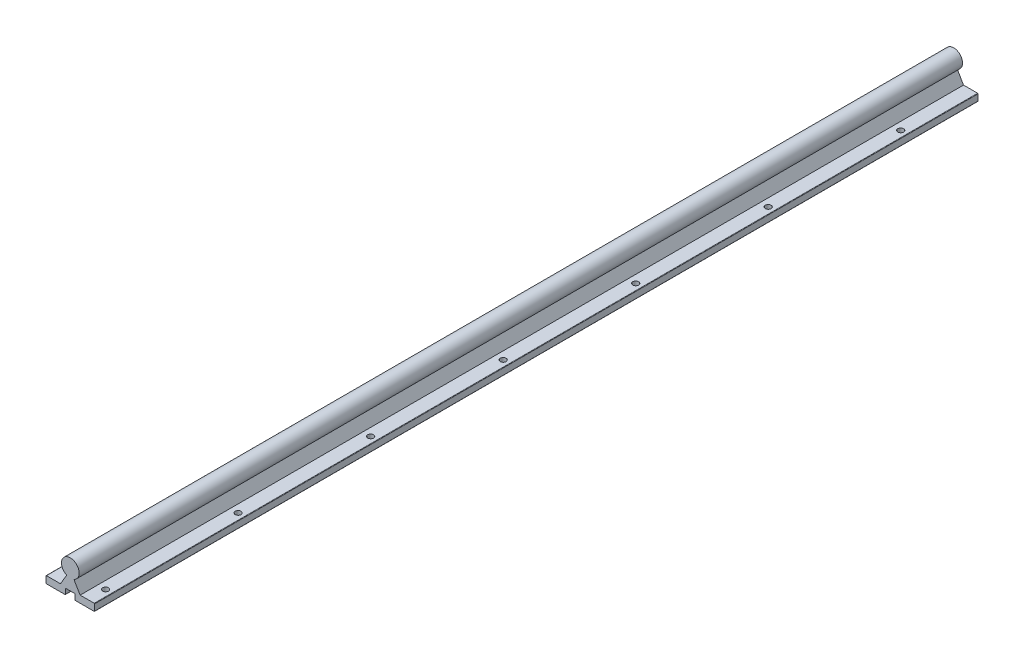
SolidWorks part; units mm, degrees
ref_plane "Front Plane" through (0, 0, 0) normal (0, 0, 1) x (1, 0, 0)
ref_plane "Top Plane" through (0, 0, 0) normal (0, 1, 0) x (1, 0, 0)
ref_plane "Right Plane" through (0, 0, 0) normal (1, 0, 0) x (0, 0, -1)
sketch "Sketch1" plane through (0, 0, 0) normal (0, 0, 1) x (1, 0, 0)
  line L0 (-5, 2.5) -> (5, 2.5)
  line L1 (-27, 4) -> (-11.1518, 4)
  line L2 (-27.5, 3.5) -> (-27.5, -3.5)
  line L3 (-27, -4) -> (-6, -4)
  line L4 (27.5, 3.5) -> (27.5, -3.5)
  line L5 (-27.5, 4) -> (-5.5, 0.8) construction
  line L6 (-27.5, -4) -> (-5.5, -0.8) construction
  line L8 (-5.5, 2) -> (-5.5, -3.5)
  line L10 (5.5, 2) -> (5.5, -3.5)
  line L13 (6, -4) -> (27, -4)
  line L14 (5.5, 0.8) -> (27.5, 4) construction
  line L15 (5.5, -0.8) -> (27.5, -4) construction
  line L16 (-11.1518, 4) -> (-4.3953, 15.395)
  line L17 (0, -55) -> (0, 55) construction
  line L18 (11.1518, 4) -> (4.3953, 15.395)
  line L19 (-3.9652, 15.64) -> (-3.52, 15.64)
  line L20 (3.52, 15.64) -> (3.9652, 15.64)
  line L22 (11.1518, 4) -> (27, 4)
  arc A0 (3.52, 15.64) -> (-3.52, 15.64) centre (0, 25) ccw
  arc A1 (4.3953, 15.395) -> (3.9652, 15.64) centre (3.9652, 15.14) ccw
  arc A2 (-4.3953, 15.395) -> (-3.9652, 15.64) centre (-3.9652, 15.14) cw
  arc A3 (27, -4) -> (27.5, -3.5) centre (27, -3.5) ccw
  arc A4 (27, 4) -> (27.5, 3.5) centre (27, 3.5) cw
  arc A5 (-5.5, -3.5) -> (-6, -4) centre (-6, -3.5) cw
  arc A6 (6, -4) -> (5.5, -3.5) centre (6, -3.5) cw
  arc A7 (5, 2.5) -> (5.5, 2) centre (5, 2) cw
  arc A8 (-5, 2.5) -> (-5.5, 2) centre (-5, 2) ccw
  arc A9 (-27.5, -3.5) -> (-27, -4) centre (-27, -3.5) ccw
  arc A10 (-27, 4) -> (-27.5, 3.5) centre (-27, 3.5) ccw
  point P0 (0, 0)
  point P6 (0, 0)
  point P16 (4.25, 15.64)
  point P29 (-4.25, 15.64)
  point P40 (5.5, -4)
  dimension "D8" = 20
  dimension "D9" = 0.5
  dimension "D1" = 8
  dimension "D2" = 55
  dimension "D3" = 11
  dimension "D4" = 6.5
  dimension "D5" = 19.64
  dimension "D6" = 8.5
  dimension "D7" = 29
extrude "Boss-Extrude1" add sketch "Sketch1" along normal blind 1000
sketch "Sketch2" plane through (0, 4, 0) normal (0, 1, 0) x (1, 0, 0)
  line L0 (27.5, -1000) -> (27.5, 0) construction
  line L1 (27, -1000) -> (11.1518, -1000) construction
  point P0 (20, -980)
  dimension "D1" = 7.5
  dimension "D2" = 20
hole_wizard "Ø6.6 (6.6) Diameter Hole1" positions "Sketch2" profile "Sketch3" hole size "Ø6.6" standard "DIN"
sketch "Sketch3" plane through (20, 4, 980) normal (1, 0, 0) x (0, 0, 1)
  line L0 (0, 0) -> (0, 8)
  line L1 (0, 8) -> (3.3, 8)
  line L2 (3.3, 8) -> (3.3, 0)
  line L5 (3.3, 0) -> (0, 0)
  line L11 (0, -6.35) -> (0, 107.95) construction
  dimension "Thru Hole Dia." = 6.6
  dimension "Thru Hole Depth" = 8
mirror "Mirror1" about plane through (0, 0, 0) normal (1, 0, 0) of "Ø6.6 (6.6) Diameter Hole1"
other "Fill Pattern1" parameters "D5"=0, "D6"=0, "D1"=150, "D2"=60, "D3"=0, "D9"=7, "D7"=8, "D8"=2
